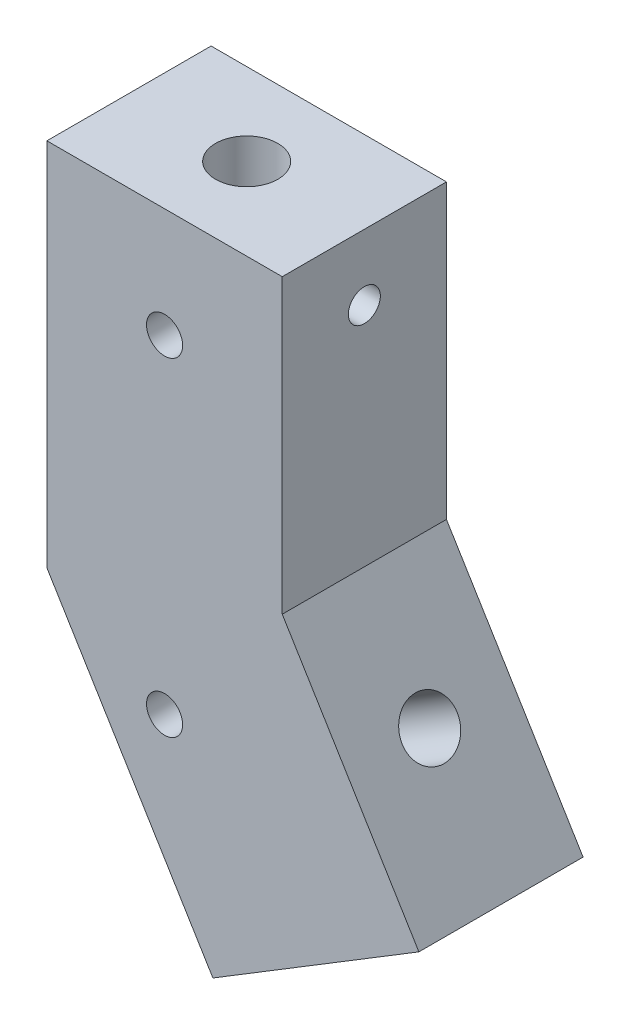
SolidWorks part; units mm, degrees
ref_plane "Plan de face" through (0, 0, 0) normal (0, 0, 1) x (1, 0, 0)
ref_plane "Plan de dessus" through (0, 0, 0) normal (0, 1, 0) x (1, 0, 0)
ref_plane "Plan de droite" through (0, 0, 0) normal (1, 0, 0) x (0, 0, -1)
sketch "Esquisse1" plane through (0, 0, 0) normal (0, 0, 1) x (1, 0, 0)
  line L0 (0, 0) -> (820, 0) construction
  line L1 (820, 0) -> (0, -500) construction
  line L2 (0, -500) -> (0, 0) construction
  line L3 (-62.7003, -406.6265) -> (62.7003, -406.6265)
  line L4 (62.7003, -406.6265) -> (111.7204, -487.0194)
  line L5 (111.7204, -487.0194) -> (20.3073, -542.7591)
  line L6 (20.3073, -542.7591) -> (-62.7003, -406.6265)
  dimension "D1" = 500
  dimension "D2" = 820
extrude "Boss.-Extru.1" add sketch "Esquisse1" along normal mid plane 30
sketch "Esquisse2" plane through (0, -406.6265, 0) normal (0, 1, 0) x (1, 0, 0)
  circle A0 centre (0, 0) radius 5.6888
extrude "Enlèv. mat.-Extru.1" cut sketch "Esquisse2" against normal blind 30
sketch "Esquisse3" plane through (-135.036, -82.339, 0) normal (0.8538, 0.5206, 0) x (0, 0, -1)
  line L0 (-15, -473.9778) -> (15, -379.8184) construction
  circle A0 centre (0, -426.8981) radius 5.029
extrude "Enlèv. mat.-Extru.2" cut sketch "Esquisse3" against normal through all
sketch "Esquisse4" plane through (0, 0, 15) normal (0, 0, 1) x (1, 0, 0)
  line L0 (0, -436.6265) -> (0, -402.1049) construction
  line L1 (5.6888, -436.6265) -> (-5.6888, -436.6265) construction
  line L2 (46.4676, -500.981) -> (21.5, -460.0342)
  line L3 (-68.5415, -402.1049) -> (-21.5, -402.1049)
  line L4 (-68.5415, -402.1049) -> (-68.5415, -482.2219)
  line L5 (-68.5415, -482.2219) -> (-21.5, -482.2219)
  line L6 (-21.5, -402.1049) -> (-21.5, -482.2219)
  line L7 (21.5, -402.1049) -> (129.7239, -402.1049)
  line L8 (21.5, -402.1049) -> (21.5, -460.0342)
  line L9 (-1.5846, -506.8563) -> (89.8285, -451.1167) construction
  line L10 (129.7239, -402.1049) -> (129.7239, -519.8078)
  line L11 (20.3073, -542.7591) -> (111.7204, -487.0194) construction
  line L12 (57.9474, -519.8078) -> (129.7239, -519.8078)
  line L13 (57.9474, -519.8078) -> (12.6145, -547.4498)
  line L14 (46.4676, -500.981) -> (1.1348, -528.623)
  line L15 (12.6145, -547.4498) -> (1.1348, -528.623)
  line L16 (62.7003, -406.6265) -> (-62.7003, -406.6265) construction
  circle A0 centre (0, -426.6265) radius 3.3
  circle A1 centre (0, -486.6265) radius 3.3
  dimension "D4" = 60
  dimension "D5" = 20
  dimension "D6" = 6.6
  dimension "D1" = 43
  dimension "D2" = 21.5
  dimension "D3" = 20
extrude "Enlèv. mat.-Extru.3" cut sketch "Esquisse4" against normal through all
sketch "Esquisse5" plane through (-21.5, 0, 0) normal (-1, 0, 0) x (0, 0, 1)
  line L0 (-15, -406.6265) -> (15, -406.6265) construction
  circle A0 centre (0, -418.6265) radius 2.925
  dimension "D1" = 5.85
  dimension "D2" = 12
extrude "Enlèv. mat.-Extru.4" cut sketch "Esquisse5" against normal through all
